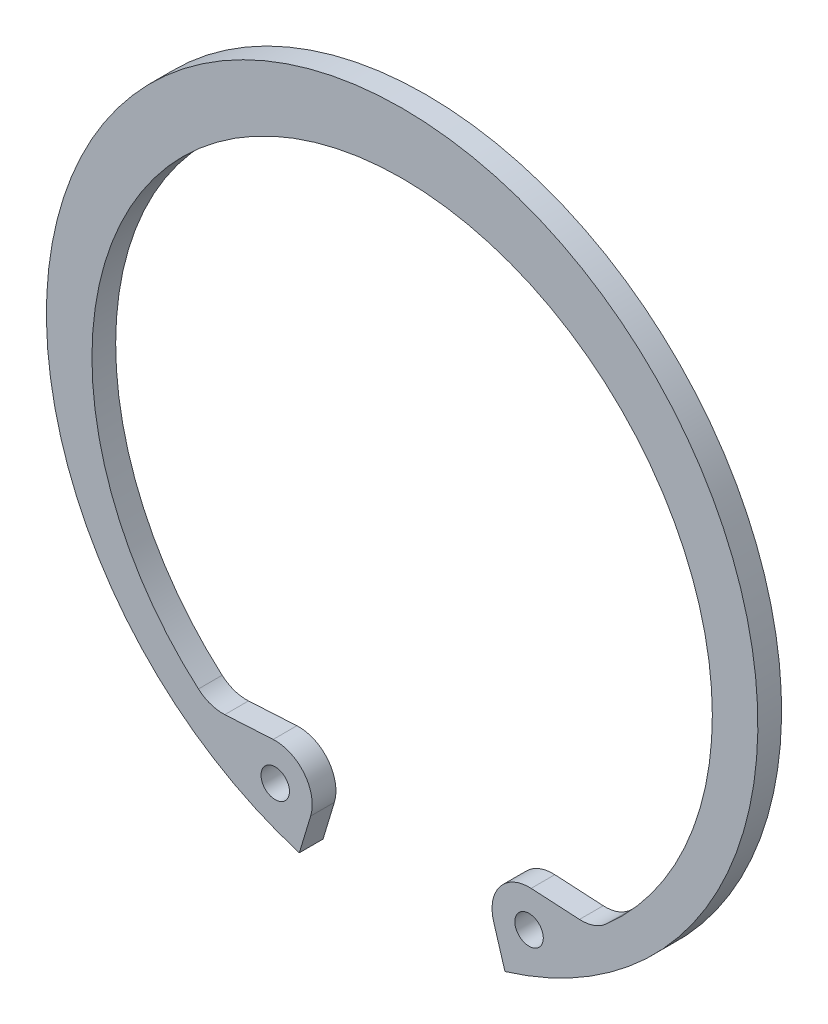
SolidWorks part; units mm, degrees
ref_plane "Face" through (0, 0, 0) normal (0, 0, 1) x (1, 0, 0)
ref_plane "Dessus" through (0, 0, 0) normal (0, 1, 0) x (1, 0, 0)
ref_plane "Droite" through (0, 0, 0) normal (1, 0, 0) x (0, 0, -1)
sketch "Esquisse1" plane through (0, 0, 0) normal (0, 0, 1) x (1, 0, 0)
  line L0 (0, 31.1) -> (0, 37.5) construction
  line L1 (9.6458, -31.9485) -> (10.8387, -35.8995)
  line L2 (11.8264, -27.2438) -> (14.9323, -34.3988) construction
  line L3 (18.6964, -27.2125) -> (13.5971, -26.9274)
  line L4 (-18.6964, -27.2125) -> (-13.5971, -26.9274)
  line L5 (-9.6458, -31.9485) -> (-10.8387, -35.8995)
  line L6 (11.6707, -32.065) -> (13.0823, -35.9432) construction
  line L7 (-11.6707, -32.065) -> (-13.0823, -35.9432) construction
  arc A0 (10.8387, -35.8995) -> (-10.8387, -35.8995) centre (0, 0) ccw
  arc A1 (21.4754, -26.2596) -> (-21.4754, -26.2596) centre (0, -1.6) ccw
  arc A2 (13.5971, -26.9274) -> (9.6458, -31.9485) centre (13.3794, -30.8213) ccw
  arc A3 (18.6964, -27.2125) -> (21.4754, -26.2596) centre (18.9141, -23.3186) ccw
  circle A4 centre (13.3794, -30.8213) radius 1.5
  arc A5 (-18.6964, -27.2125) -> (-21.4754, -26.2596) centre (-18.9141, -23.3186) cw
  circle A6 centre (-13.3794, -30.8213) radius 1.5
  arc A7 (-13.5971, -26.9274) -> (-9.6458, -31.9485) centre (-13.3794, -30.8213) cw
  arc A8 (13.0823, -35.9432) -> (-13.0823, -35.9432) centre (0, 0) ccw construction
  circle A9 centre (0, 0) radius 36 construction
  dimension "dgorge" = 75
  dimension "D3" = 1.6
  dimension "dtrou" = 3
  dimension "dext" = 76.5
  dimension "dn" = 72
  dimension "b" = 6.4
  dimension "a" = 7.8
  dimension "D5" = 70
  dimension "D7" = 33.6
  dimension "D9" = 40
extrude "Base-Extrusion" add sketch "Esquisse1" along normal blind 2.5
equation "\"D3@Esquisse1\" = \"b@Esquisse1\"/4"
equation "\"D7@Esquisse1\" = 360-(360-\"D9@Esquisse1\")*\"dext@Esquisse1\"/\"dgorge@Esquisse1\""
